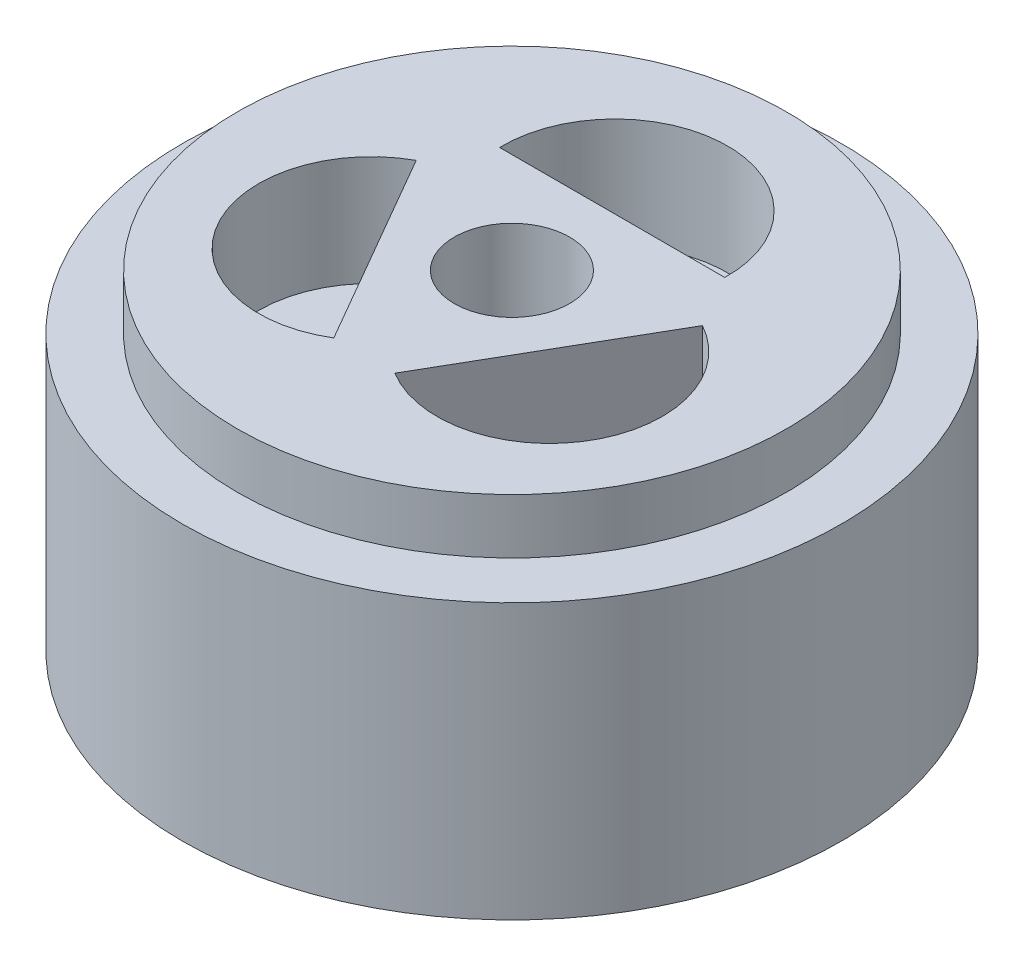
SolidWorks part; units mm, degrees
ref_plane "Front Plane" through (0, 0, 0) normal (0, 0, 1) x (1, 0, 0)
ref_plane "Top Plane" through (0, 0, 0) normal (0, 1, 0) x (1, 0, 0)
ref_plane "Right Plane" through (0, 0, 0) normal (1, 0, 0) x (0, 0, -1)
sketch "Original Sketch" plane through (0, 0, 0) normal (0, 1, 0) x (1, 0, 0)
  line L0 (7.3371, 0.6082) -> (3.1418, -6.6582) construction
  line L1 (-4.1952, 6.05) -> (4.1952, 6.05) construction
  line L2 (-3.1418, -6.6582) -> (-7.3371, 0.6082) construction
  circle A0 centre (0, 0) radius 4.1 construction
  arc A1 (3.1418, -6.6582) -> (7.3371, 0.6082) centre (5.4127, -3.125) ccw construction
  arc A2 (4.1952, 6.05) -> (-4.1952, 6.05) centre (0, 6.25) ccw construction
  arc A3 (-7.3371, 0.6082) -> (-3.1418, -6.6582) centre (-5.4127, -3.125) ccw construction
  circle A4 centre (0, 0) radius 14.5 construction
  circle A5 centre (0, 0) radius 12.4 construction
sketch "Sketch2" plane through (0, 0, 0) normal (0, 1, 0) x (1, 0, 0)
  line L1 (-4.1952, 3.55) -> (4.1952, 3.55)
  line L2 (5.172, 1.8582) -> (0.9768, -5.4082)
  line L3 (-0.9768, -5.4082) -> (-5.172, 1.8582)
  arc A1 (4.1952, 3.55) -> (-4.1952, 3.55) centre (0, 3.75) ccw
  arc A2 (0.9768, -5.4082) -> (5.172, 1.8582) centre (3.2476, -1.875) ccw
  arc A3 (-5.172, 1.8582) -> (-0.9768, -5.4082) centre (-3.2476, -1.875) ccw
  circle A4 centre (0, 0) radius 2.0464
  circle A5 centre (0, 0) radius 9.95 construction
  point P12 (0, 0)
  dimension "D1" = 3
sketch "Sketch3" plane through (0, 0, 0) normal (0, 1, 0) x (1, 0, 0)
  line L0 (-0.9768, -5.4082) -> (-5.172, 1.8582) construction
  circle A0 centre (0, 0) radius 12
extrude "Boss-Extrude1" add sketch "Sketch3" along normal blind 10
sketch "Sketch4" plane through (0, 10, 0) normal (0, 1, 0) x (1, 0, 0)
  circle A0 centre (0, 0) radius 10
extrude "Boss-Extrude2" add sketch "Sketch4" along normal blind 2
sketch "Sketch6" plane through (0, 12, 0) normal (0, 1, 0) x (1, 0, 0)
  line L0 (-0.9768, -5.4082) -> (-5.172, 1.8582) construction
  line L1 (5.172, 1.8582) -> (0.9768, -5.4082) construction
  line L2 (-4.1952, 3.55) -> (4.1952, 3.55) construction
  line L3 (-0.9768, -5.4082) -> (-5.172, 1.8582) construction
  line L4 (5.172, 1.8582) -> (0.9768, -5.4082) construction
  line L5 (-4.1952, 3.55) -> (4.1952, 3.55) construction
  line L6 (-4.0988, 3.65) -> (4.0988, 3.65)
  line L7 (5.2104, 1.7246) -> (1.1116, -5.3746)
  line L8 (-1.1116, -5.3746) -> (-5.2104, 1.7246)
  circle A0 centre (0, 0) radius 2.0464 construction
  arc A1 (-5.172, 1.8582) -> (-0.9768, -5.4082) centre (-3.2476, -1.875) ccw construction
  arc A2 (0.9768, -5.4082) -> (5.172, 1.8582) centre (3.2476, -1.875) ccw construction
  arc A3 (4.1952, 3.55) -> (-4.1952, 3.55) centre (0, 3.75) ccw construction
  circle A4 centre (0, 0) radius 2.0464 construction
  arc A5 (-5.172, 1.8582) -> (-0.9768, -5.4082) centre (-3.2476, -1.875) ccw construction
  arc A6 (0.9768, -5.4082) -> (5.172, 1.8582) centre (3.2476, -1.875) ccw construction
  arc A7 (4.1952, 3.55) -> (-4.1952, 3.55) centre (0, 3.75) ccw construction
  arc A8 (4.0988, 3.65) -> (-4.0988, 3.65) centre (0, 3.75) ccw
  arc A9 (1.1116, -5.3746) -> (5.2104, 1.7246) centre (3.2476, -1.875) ccw
  arc A10 (-5.2104, 1.7246) -> (-1.1116, -5.3746) centre (-3.2476, -1.875) ccw
  dimension "D1" = 0.1
  dimension "D2" = 0.1
  dimension "D3" = 0.1
extrude "Cut-Extrude1" cut sketch "Sketch6" against normal blind 4
sketch "Sketch7" plane through (0, 12, 0) normal (0, 1, 0) x (1, 0, 0)
  circle A0 centre (0, 0) radius 2 construction
  circle A1 centre (0, 0) radius 2.1
  dimension "D1" = 0.1
extrude "Cut-Extrude2" cut sketch "Sketch7" against normal blind 20
